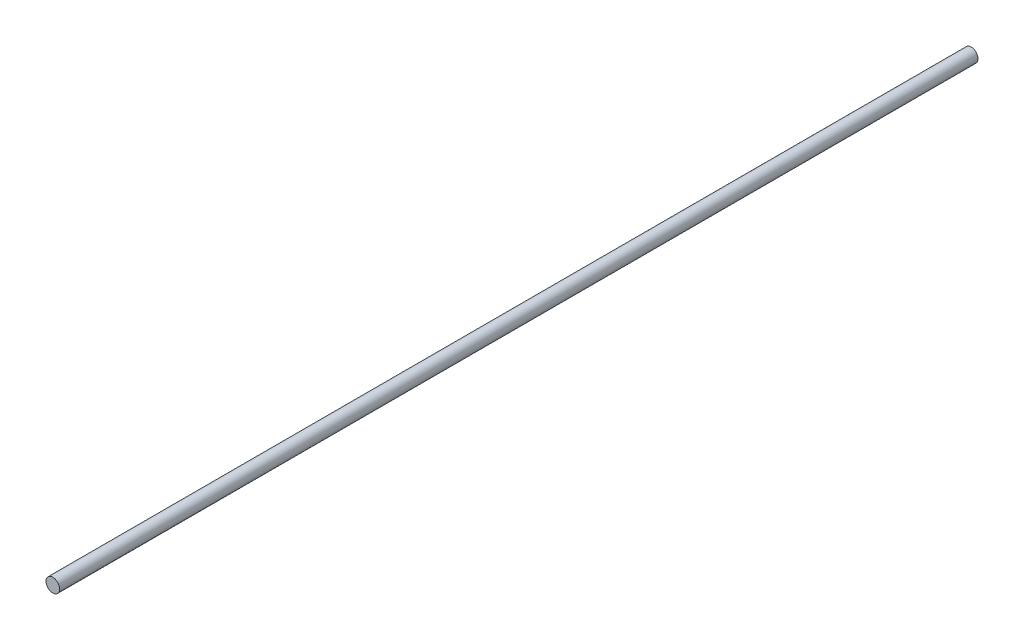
SolidWorks part; units mm, degrees
ref_plane "Front Plane" through (0, 0, 0) normal (0, 0, 1) x (1, 0, 0)
ref_plane "Top Plane" through (0, 0, 0) normal (0, 1, 0) x (1, 0, 0)
ref_plane "Right Plane" through (0, 0, 0) normal (1, 0, 0) x (0, 0, -1)
sketch "Sketch1" plane through (0, 0, 0) normal (0, 0, 1) x (1, 0, 0)
  circle A0 centre (0, 0) radius 30
  dimension "D1" = 60
extrude "Boss-Extrude1" add sketch "Sketch1" against normal blind 4050
